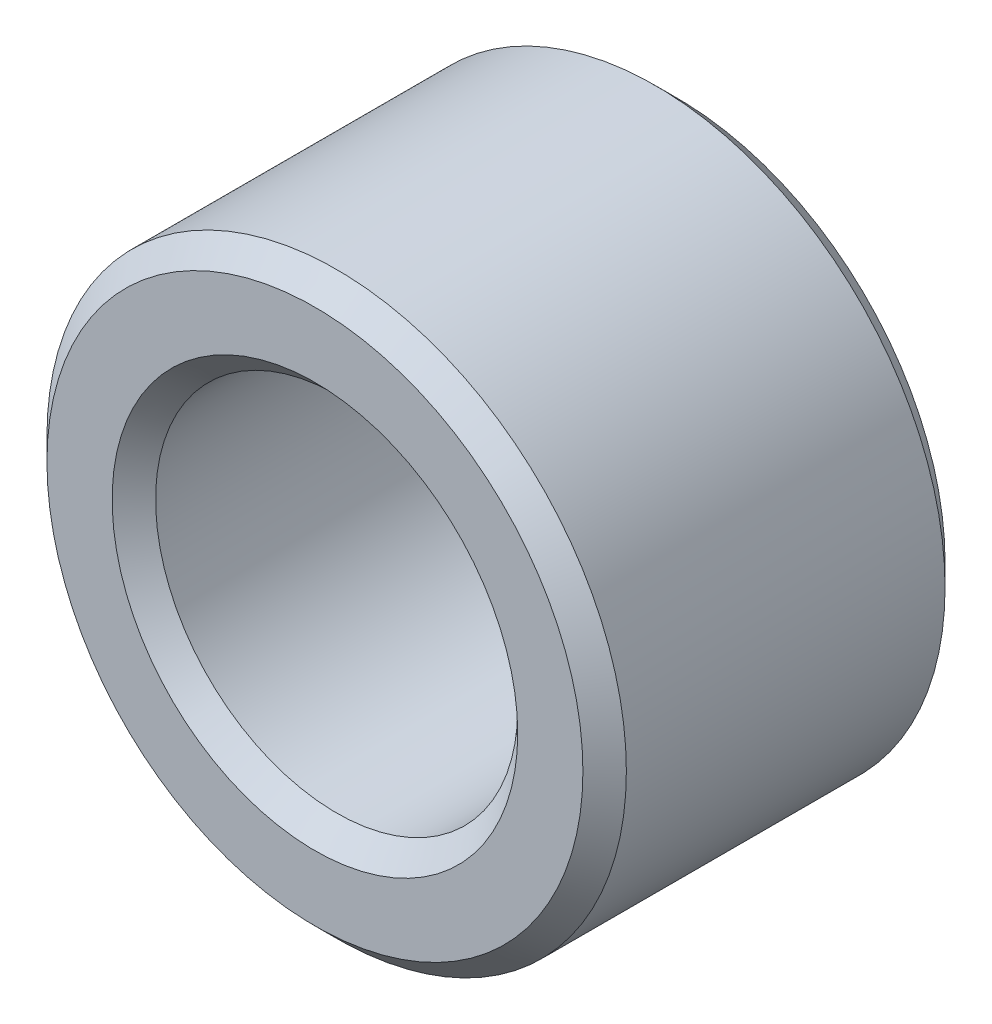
SolidWorks part; units mm, degrees
ref_plane "FACE" through (0, 0, 0) normal (0, 0, 1) x (1, 0, 0)
ref_plane "DESSUS" through (0, 0, 0) normal (0, 1, 0) x (1, 0, 0)
ref_plane "GAUCHE" through (0, 0, 0) normal (1, 0, 0) x (0, 0, -1)
sketch "Esquisse1" plane through (0, 0, 0) normal (0, 0, 1) x (1, 0, 0)
  circle A0 centre (0, 0) radius 2.5
  circle A1 centre (0, 0) radius 4
  dimension "D1" = 5
  dimension "D2" = 8
extrude "Base-Extrusion" add sketch "Esquisse1" along normal blind 5
chamfer "Chanfrein1" distance 0.3 angle 45
